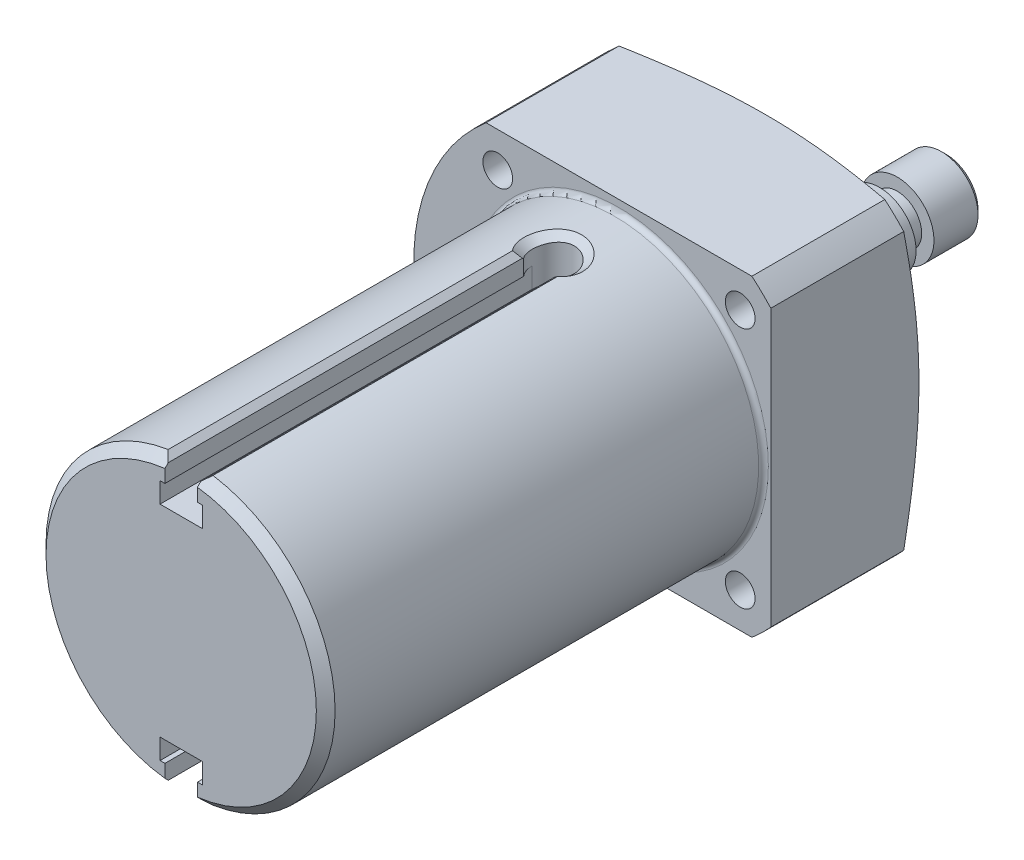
SolidWorks part; units mm, degrees
ref_plane "Front Plane" through (0, 0, 0) normal (0, 0, 1) x (1, 0, 0)
ref_plane "Top Plane" through (0, 0, 0) normal (0, 1, 0) x (1, 0, 0)
ref_plane "Right Plane" through (0, 0, 0) normal (1, 0, 0) x (0, 0, -1)
sketch "Sketch1" plane through (0, 0, 0) normal (0, 0, 1) x (1, 0, 0)
  line L0 (0, 0) -> (62.0084, 0) construction
  line L1 (-21.5923, 25.4) -> (21.5923, 25.4)
  line L2 (24.6634, 22.43) -> (24.6634, -22.43)
  line L3 (-21.5923, -25.4) -> (21.5923, -25.4)
  arc A0 (-21.5923, 25.4) -> (-21.5923, -25.4) centre (0, 0) ccw
  arc A1 (24.6634, 22.43) -> (21.5923, 25.4) centre (0, 0) ccw
  arc A2 (21.5923, -25.4) -> (24.6634, -22.43) centre (0, 0) ccw
  dimension "D1" = 66.675
  dimension "D2" = 50.8
  dimension "D3" = 24.6634
extrude "Extrude1" add sketch "Sketch1" along normal blind 99.314
sketch "Sketch2" plane through (0, 0, 0) normal (0, 1, 0) x (1, 0, 0)
  line L0 (0, 0) -> (0, -96.9332) construction
  line L1 (-33.3375, -28.194) -> (-23.4823, -28.194)
  line L2 (-33.3375, 0) -> (-33.3375, -99.314) construction
  line L3 (-23.4823, -28.194) -> (-23.4823, -99.314)
  line L5 (-10.16, 0) -> (-33.3375, -6.604)
  line L6 (21.5923, 0) -> (-21.5923, 0) construction
  line L7 (-23.4823, -99.314) -> (-33.3375, -99.314)
  line L8 (-33.3375, -99.314) -> (-33.3375, -28.194)
  line L9 (-33.3375, -6.604) -> (-33.3375, 0)
  line L10 (-21.5923, 0) -> (-33.3375, 0) construction
  line L11 (-33.3375, 0) -> (-10.16, 0)
  dimension "D1" = 71.12
  dimension "D2" = 46.9646
  dimension "D5" = 20.32
  dimension "D6" = 6.604
revolve "Cut-Revolve1" cut sketch "Sketch2" angle 360 about L0
sketch "Sketch4" plane through (0, 0, 0) normal (0, 1, 0) x (1, 0, 0)
  line L0 (0, 0) -> (0, -99.9671) construction
  line L1 (6.3437, 0) -> (6.3436, 7.493)
  line L2 (10.16, 0) -> (-10.16, 0) construction
  line L3 (6.3436, 7.493) -> (5.9372, 14.1376)
  line L4 (5.9372, 14.1376) -> (0, 14.1376)
  line L5 (-21.5923, -28.194) -> (21.5923, -28.194) construction
  line L7 (0, 14.1376) -> (0, 0)
  line L8 (0, 0) -> (6.3437, 0)
  dimension "D1" = 3.5
  dimension "D2" = 35.687
  dimension "D4" = 12.6873
  dimension "D5" = 11.8745
  dimension "D6" = 6.6446
revolve "Revolve1" add sketch "Sketch4" angle 360 about L0
hole_wizard "Hole1" positions "Sketch6" profile "Sketch5" legacy
sketch "Sketch6" plane through (0, 0, -14.1376) normal (0, 0, -1) x (-1, 0, 0)
  circle A0 centre (0, 0) radius 5.9372 construction
  point P0 (0, 0)
sketch "Sketch5" plane through (0, 0, -14.1376) normal (1, 0, 0) x (0, 1, 0)
  line L0 (0, 0) -> (0, 21.0111)
  line L1 (0, 21.0111) -> (3.2639, 19.05)
  line L2 (3.2639, 19.05) -> (3.2639, 0)
  line L4 (3.2639, 0) -> (0, 0)
  line L6 (0, 21.0111) -> (-3.2639, 19.05) construction
  line L7 (0, -4.2442) -> (0, 117.3081) construction
  dimension "Diameter" = 6.5278
  dimension "Depth" = 19.05
  dimension "Drill Angle" = 118
hole_wizard "Hole2" positions "Sketch10" profile "Sketch9" legacy
sketch "Sketch10" plane through (4.4648, 0.3939, 0) normal (0, 0, 1) x (1, 0, 0)
  line L1 (-4.4648, -0.3939) -> (19.5659, -0.3939) construction
  line L2 (-4.4648, -0.3939) -> (15.2289, 19.2998) construction
  circle A0 centre (-4.4648, -0.3939) radius 27.8511 construction
  point P0 (15.2289, 19.2998)
  dimension "D2" = 55.7022
  dimension "D1" = 45
sketch "Sketch9" plane through (19.6937, 19.6937, 0) normal (1, 0, 0) x (0, 1, 0)
  line L0 (0, 0) -> (0, 28.195)
  line L1 (0, 28.195) -> (2.413, 28.195)
  line L2 (2.413, 28.195) -> (2.413, 10.1092)
  line L3 (2.413, 10.1092) -> (3.9624, 10.1092)
  line L4 (3.9624, 10.1092) -> (3.9624, 0)
  line L5 (3.9624, 0) -> (0, 0)
  line L6 (0, 110) -> (0, -10) construction
  dimension "Diameter" = 4.826
  dimension "Depth" = 28.195
  dimension "C-Bore Diameter" = 7.9248
  dimension "C-Bore Depth" = 10.1092
pattern_circular "CirPattern1" count 4 over 360 about axis through (0, 0, 0) along (0, 0, 1) of "Hole2"
ref_plane "Plane1" through (0, 0, 20.2692) normal (0, 0, 1) x (1, 0, 0)
sketch "Sketch11" plane through (0, 0, 20.2692) normal (0, 0, 1) x (1, 0, 0)
  line L0 (0, 0) -> (19.628, -9.1527) construction
  line L1 (0, 0) -> (27.0444, 0) construction
  line L2 (-69.4514, 27.7895) -> (-23.411, 6.3205)
  line L3 (-23.411, 6.3205) -> (-21.6505, 10.0958)
  line L4 (-21.6505, 10.0958) -> (-67.691, 31.5648)
  line L5 (-67.691, 31.5648) -> (-69.4514, 27.7895)
  dimension "D1" = 25
  dimension "D2" = 23.8887
  dimension "D3" = 8.3312
  dimension "D4" = 50.8
revolve "Cut-Revolve2" cut sketch "Sketch11" angle 360 about L0
mirror "Mirror1" about plane through (0, 0, 0) normal (0, 1, 0) of "Cut-Revolve2"
sketch "Sketch12" plane through (0, 0, 99.314) normal (0, 0, 1) x (1, 0, 0)
  line L0 (0, 0) -> (0, 26.7352) construction
  line L1 (-2.6416, 50.8) -> (-2.6416, 19.685)
  line L2 (-2.6416, 19.685) -> (-3.429, 19.685)
  line L3 (-3.429, 19.685) -> (-3.429, 16.383)
  line L4 (-3.429, 16.383) -> (3.429, 16.383)
  line L5 (3.429, 19.685) -> (3.429, 16.383)
  line L6 (2.6416, 19.685) -> (3.429, 19.685)
  line L7 (2.6416, 50.8) -> (2.6416, 19.685)
  line L8 (-2.6416, 50.8) -> (2.6416, 50.8)
  dimension "D1" = 5.2832
  dimension "D2" = 6.858
  dimension "D3" = 3.302
  dimension "D4" = 16.383
  dimension "D5" = 50.8
extrude "Cut-Extrude1" cut sketch "Sketch12" against normal blind 60.452
sketch "Sketch13" plane through (0, 0, 99.314) normal (0, 0, 1) x (1, 0, 0)
  line L0 (0, 0) -> (32.0428, 0) construction
  line L1 (0, 0) -> (0, -27.5102) construction
  line L2 (-3.429, -16.383) -> (3.429, -16.383)
  line L3 (3.429, -16.383) -> (3.429, -19.685)
  line L4 (3.429, -19.685) -> (2.6416, -19.685)
  line L5 (2.6416, -19.685) -> (2.6416, -50.8)
  line L6 (2.6416, -50.8) -> (-2.6416, -50.8)
  line L7 (-3.429, 16.383) -> (3.429, 16.383) construction
  line L8 (3.429, 19.685) -> (3.429, 16.383) construction
  line L9 (2.6416, 50.8) -> (2.6416, 19.685) construction
  line L10 (-2.6416, -19.685) -> (-2.6416, -50.8)
  line L11 (-3.429, -19.685) -> (-2.6416, -19.685)
  line L12 (-3.429, -16.383) -> (-3.429, -19.685)
extrude "Cut-Extrude2" cut sketch "Sketch13" against normal blind 44.704
sketch "Sketch14" plane through (0, 25.4, 0) normal (0, 1, 0) x (1, 0, 0)
  line L0 (-2.6416, -38.862) -> (2.6416, -38.862) construction
  circle A0 centre (0, -38.862) radius 3.429
  dimension "D1" = 3.429
extrude "Cut-Extrude3" cut sketch "Sketch14" against normal up to surface (9.017 mm away)
sketch "Sketch15" plane through (0, -25.4, 0) normal (0, -1, 0) x (1, 0, 0)
  line L0 (3.429, 54.61) -> (-3.429, 54.61) construction
  circle A0 centre (0, 54.61) radius 3.429
  dimension "D1" = 3.429
extrude "Cut-Extrude4" cut sketch "Sketch15" against normal up to surface (9.017 mm away)
sketch "Sketch16" plane through (0, 0, 0) normal (0, 1, 0) x (1, 0, 0)
  line L0 (0, 0) -> (0, -122.9241) construction
  line L1 (3.9624, 14.1376) -> (3.9624, 17.018)
  line L2 (5.9372, 14.1376) -> (-5.9372, 14.1376) construction
  line L3 (3.9624, 17.018) -> (5.9563, 17.018)
  line L4 (5.9563, 17.018) -> (5.9563, 24.1808)
  line L5 (5.9563, 24.1808) -> (5.1943, 24.9428)
  line L6 (5.1943, 24.9428) -> (0, 24.9428)
  line L7 (0, 24.9428) -> (0, 14.1376)
  line L8 (0, 14.1376) -> (3.9624, 14.1376)
  line L9 (-6.3436, 7.493) -> (6.3436, 7.493) construction
  dimension "D1" = 7.9248
  dimension "D2" = 9.525
  dimension "D3" = 11.9126
  dimension "D4" = 7.9248
  dimension "D5" = 45
  dimension "D6" = 10.3886
revolve "Revolve2" add sketch "Sketch16" angle 360 about L0
sketch "Sketch17" plane through (0, 0, -24.9428) normal (0, 0, -1) x (-1, 0, 0)
  line L1 (3.175, -1.8331) -> (3.175, 1.8331)
  line L2 (3.175, 1.8331) -> (0, 3.6662)
  line L3 (0, 3.6662) -> (-3.175, 1.8331)
  line L4 (-3.175, 1.8331) -> (-3.175, -1.8331)
  line L5 (-3.175, -1.8331) -> (0, -3.6662)
  line L6 (0, -3.6662) -> (3.175, -1.8331)
  circle A0 centre (0, 0) radius 3.175 construction
  dimension "D1" = 6.35
extrude "Cut-Extrude5" cut sketch "Sketch17" against normal blind 4.7498
chamfer "Chamfer1" distance 1.524 angle 45 2 edges at (-23.4823, 0, 99.314) (23.4823, 0, 99.314)
fillet "Fillet1" radius 0.7874 1 edges at (-23.4823, 0, 28.194)
chamfer "Chamfer2" distance 0.9906 angle 49.47 6 edges at (2.6416, -23.3332, 77.2932) (-0.3957, -23.479, 58.0161) (-2.6416, -23.3332, 77.2932) (-2.6416, 23.3332, 69.4192) (-0.3957, 23.479, 35.4559) (2.6416, 23.3332, 69.4192)
